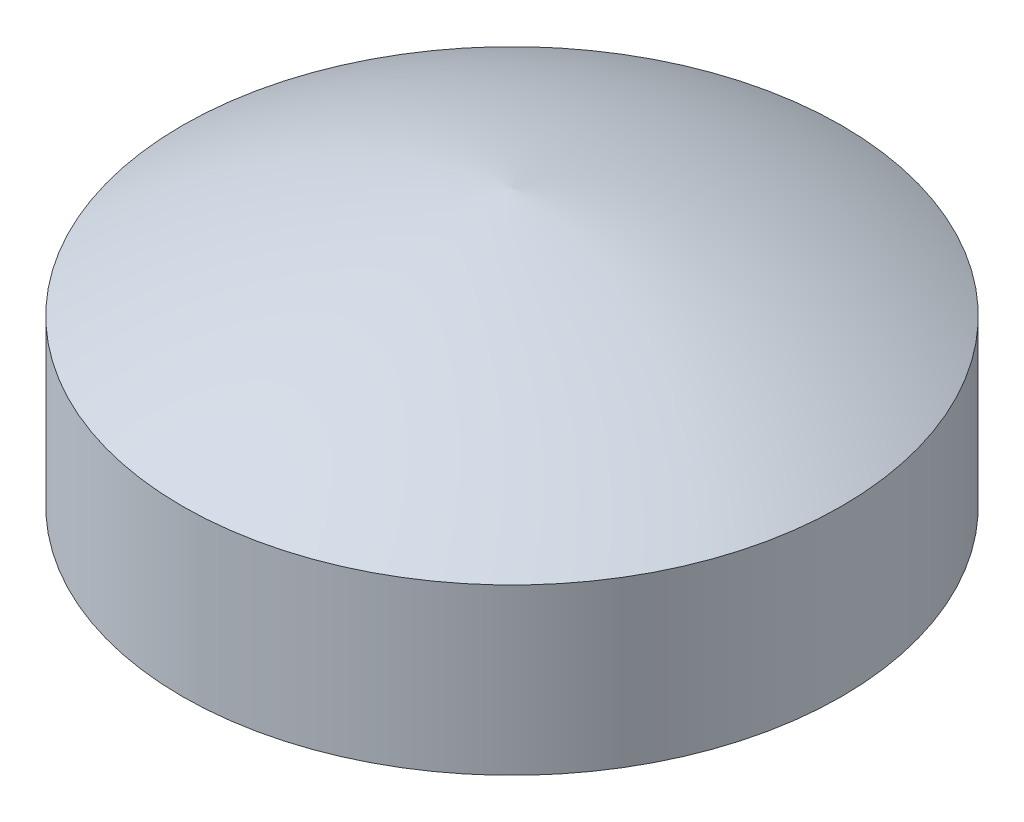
SolidWorks part; units mm, degrees
ref_plane "前视基准面" through (0, 0, 0) normal (0, 0, 1) x (1, 0, 0)
ref_plane "上视基准面" through (0, 0, 0) normal (0, 1, 0) x (1, 0, 0)
ref_plane "右视基准面" through (0, 0, 0) normal (1, 0, 0) x (0, 0, -1)
sketch "草图1" plane through (0, 0, 0) normal (0, 0, 1) x (1, 0, 0)
  line L0 (0, 0) -> (3, 0)
  line L1 (3, 0) -> (3, 1.5)
  line L2 (0, 0) -> (0, 5.9227) construction
  line L3 (0, 0) -> (0, 2.5)
  arc A0 (0, 2.5) -> (3, 1.5) centre (-0.8928, -5.1783) cw
  dimension "D4" = 7.73
  dimension "D1" = 3
  dimension "D2" = 1.5
  dimension "D3" = 2.5
revolve "旋转1" add sketch "草图1" angle 360 about L2
